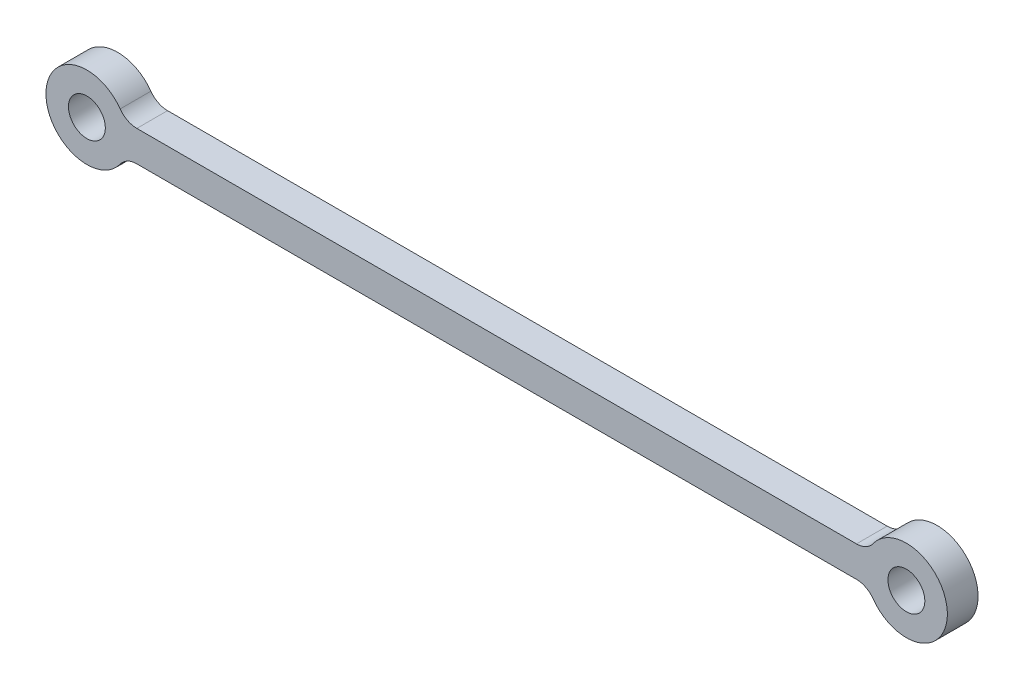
SolidWorks part; units mm, degrees
ref_plane "Front" through (0, 0, 0) normal (0, 0, 1) x (1, 0, 0)
ref_plane "Top" through (0, 0, 0) normal (0, 1, 0) x (1, 0, 0)
ref_plane "Right" through (0, 0, 0) normal (1, 0, 0) x (0, 0, -1)
sketch "Sketch1" plane through (0, 0, 0) normal (0, 0, 1) x (1, 0, 0)
  line L0 (0, 0) -> (325.6723, 0) construction
  line L1 (0, 0) -> (0, 87.9437) construction
  line L2 (-400, 15) -> (400, 15)
  line L3 (-400, -15) -> (400, -15)
  arc A0 (-400, 15) -> (-400, -15) centre (-400, 0) ccw
  arc A1 (400, -15) -> (400, 15) centre (400, 0) ccw
  dimension "D1" = 800
  dimension "D2" = 15
  dimension "D3" = 30
  dimension "D4" = 400
extrude "Extrude1" add sketch "Sketch1" along normal blind 30
sketch "Sketch2" plane through (0, 0, 30) normal (0, 0, 1) x (1, 0, 0)
  circle A0 centre (-400, 0) radius 40
  arc A1 (-400, 15) -> (-400, -15) centre (-400, 0) ccw construction
  dimension "D1" = 80
extrude "Extrude2" add sketch "Sketch2" against normal up to surface (30 mm away)
sketch "Sketch3" plane through (0, 0, 30) normal (0, 0, 1) x (1, 0, 0)
  circle A0 centre (-400, 0) radius 18
  dimension "D1" = 36
extrude "Cut-Extrude1" cut sketch "Sketch3" against normal through all
fillet "Fillet1" radius 20 2 edges at (-362.919, -15, 15) (-362.919, 15, 15)
mirror "Mirror1" about plane through (0, 0, 0) normal (1, 0, 0) of "Fillet1", "Extrude2", "Cut-Extrude1"
